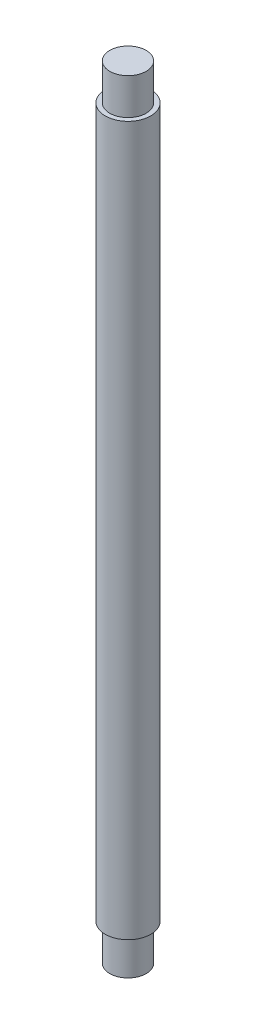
SolidWorks part; units mm, degrees
ref_plane "Front" through (0, 0, 0) normal (0, 0, 1) x (1, 0, 0)
ref_plane "Top" through (0, 0, 0) normal (0, 1, 0) x (1, 0, 0)
ref_plane "Right" through (0, 0, 0) normal (1, 0, 0) x (0, 0, -1)
sketch "Sketch1" plane through (0, 0, 0) normal (0, 0, 1) x (1, 0, 0)
  line L0 (0, 63.398) -> (0, -55.5434) construction
  line L1 (0, 86) -> (4, 86)
  line L2 (4, 86) -> (4, 78)
  line L3 (4, 78) -> (5, 78)
  line L4 (5, 78) -> (5, -78)
  line L5 (5, -78) -> (4, -78)
  line L6 (4, -78) -> (4, -86)
  line L7 (4, -86) -> (0, -86)
  line L8 (0, -86) -> (0, 86)
  dimension "D1" = 8
  dimension "D2" = 10
  dimension "D3" = 8
  dimension "D4" = 172
  dimension "D5" = 8
  dimension "D6" = 86
  dimension "D7" = 8
revolve "Revolve1" add sketch "Sketch1" angle 360 about L0
